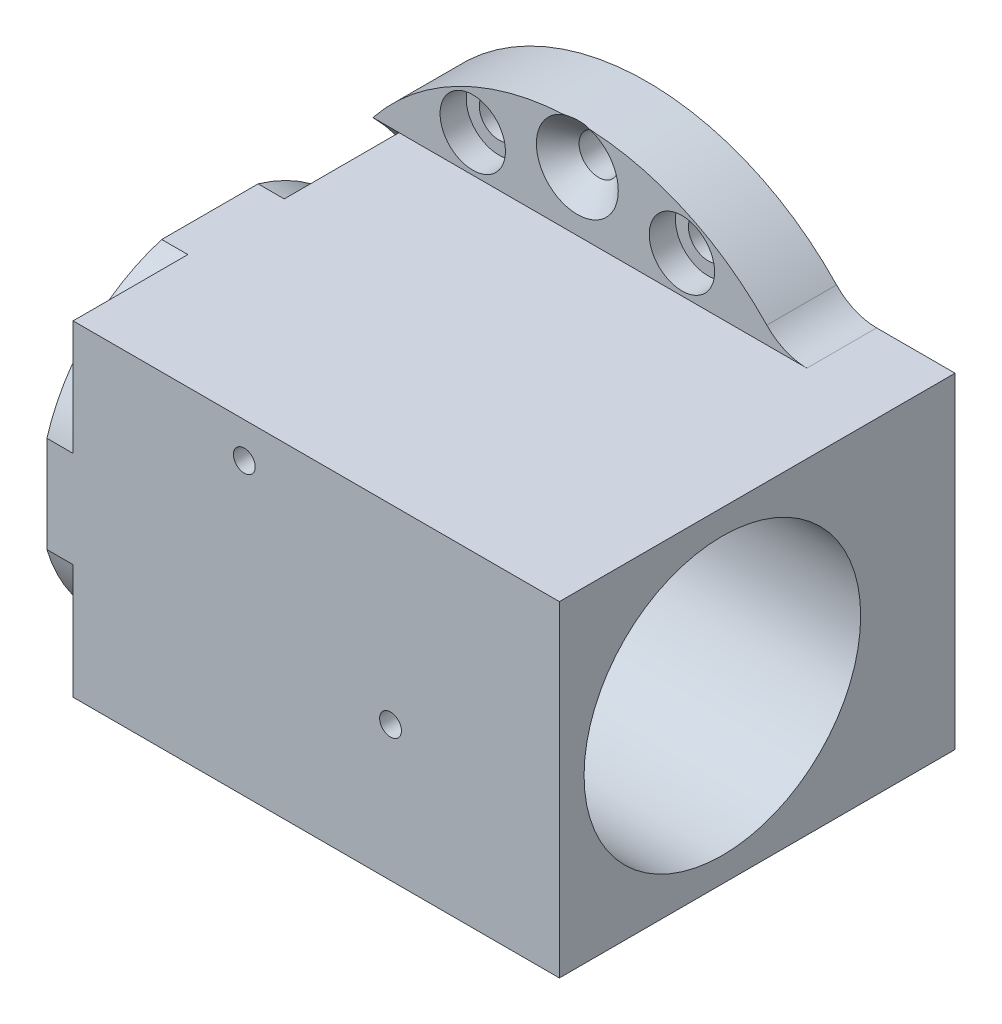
SolidWorks part; units mm, degrees
ref_plane "Front Plane" through (0, 0, 0) normal (0, 0, 1) x (1, 0, 0)
ref_plane "Top Plane" through (0, 0, 0) normal (0, 1, 0) x (1, 0, 0)
ref_plane "Right Plane" through (0, 0, 0) normal (1, 0, 0) x (0, 0, -1)
ref_plane "Plane1" through (0, 0, 8) normal (0, 0, 1) x (1, 0, 0)
sketch "Sketch1" plane through (0, 0, 8) normal (0, 0, 1) x (1, 0, 0)
  line L0 (-23.4587, 18.7) -> (-23.4587, -18.7)
  line L1 (23.4587, -18.7) -> (35.3413, -18.7)
  line L2 (35.3413, -18.7) -> (35.3413, 18.7)
  line L3 (35.3413, 18.7) -> (23.4587, 18.7)
  arc A0 (-23.4587, -18.7) -> (23.4587, -18.7) centre (0, 0) ccw
  arc A1 (23.4587, 18.7) -> (-23.4587, 18.7) centre (0, 0) ccw
extrude "Boss-Extrude1" add sketch "Sketch1" against normal blind 8
ref_plane "Plane2" through (-23.4587, 0, 0) normal (-1, 0, 0) x (0, -1, 0)
ref_plane "Plane3" through (-20.4587, 0, 0) normal (1, 0, 0) x (0, 0, -1)
sketch "Sketch3" plane through (-20.4587, 0, 0) normal (1, 0, 0) x (0, 0, -1)
  line L0 (-8, 18.7) -> (-8, -18.7)
  arc A0 (-8, -18.7) -> (-8, 18.7) centre (-26.7, 0) ccw
extrude "Cut-Extrude1" cut sketch "Sketch3" against normal up to surface
sketch "Sketch4" plane through (0, 0, 8) normal (0, 0, 1) x (1, 0, 0)
  line L0 (-20.4587, -18.7) -> (-20.4587, 18.7)
  line L1 (-20.4587, 18.7) -> (35.3413, 18.7)
  line L2 (35.3413, 18.7) -> (35.3413, -18.7)
  line L3 (35.3413, -18.7) -> (-20.4587, -18.7)
extrude "Boss-Extrude2" add sketch "Sketch4" along normal blind 37.4
sketch "Sketch5" plane through (-20.4587, 0, 0) normal (-1, 0, 0) x (0, 0, 1)
  line L0 (21.1719, 18.7) -> (45.4, 18.7)
  line L1 (45.4, 18.7) -> (45.4, -18.7)
  line L2 (45.4, -18.7) -> (21.1719, -18.7)
  arc A0 (21.1719, -18.7) -> (21.1719, 18.7) centre (26.7, 0) cw
extrude "Boss-Extrude3" add sketch "Sketch5" along normal blind 3
sketch "Sketch6" plane through (-23.4587, 0, 0) normal (-1, 0, 0) x (0, 0, 1)
  line L0 (45.4, -18.7) -> (45.4, -5.5281)
  line L1 (32.2281, -18.7) -> (45.4, -18.7)
  arc A0 (45.4, -5.5281) -> (32.2281, -18.7) centre (26.7, 0) cw
extrude "Cut-Extrude2" cut sketch "Sketch6" against normal blind 3
sketch "Sketch7" plane through (-23.4587, 0, 0) normal (-1, 0, 0) x (0, 0, 1)
  line L0 (45.4, 18.7) -> (32.2281, 18.7)
  line L1 (45.4, 5.5281) -> (45.4, 18.7)
  arc A0 (32.2281, 18.7) -> (45.4, 5.5281) centre (26.7, 0) cw
extrude "Cut-Extrude3" cut sketch "Sketch7" against normal blind 3
ref_plane "Plane4" through (0, 0, 26.7) normal (0, 0, 1) x (1, 0, 0)
sketch "Sketch8" plane through (0, 0, 26.7) normal (0, 0, 1) x (1, 0, 0)
  line L0 (-23.4587, 15.8686) -> (-23.4587, 0)
  line L1 (-23.4587, 0) -> (35.3413, 0)
  line L2 (35.3413, 0) -> (35.3413, 15.8687)
  line L3 (35.3413, 15.8687) -> (9.9413, 15.8687)
  line L4 (9.9413, 15.8687) -> (9.9413, 13.5)
  line L5 (9.9413, 13.5) -> (1.9413, 13.5)
  line L6 (1.9413, 13.5) -> (1.9413, 15.8686)
  line L7 (1.9413, 15.8686) -> (-23.4587, 15.8686)
  line L8 (-23.4587, 0) -> (35.3413, 0) construction
revolve "Cut-Revolve1" cut sketch "Sketch8" angle 360 about L8
hole_wizard "CSK for #8 Flat Head Machine Screw (100)1" positions "Sketch10" profile "Sketch9" countersink size "#8" standard "ANSI Inch"
sketch "Sketch10" plane through (0, 0, 8) normal (0, 0, 1) x (1, 0, 0)
  point P0 (0, 25.5)
  point P1 (0, -25.5)
sketch "Sketch9" plane through (0, 25.5, 8) normal (1, 0, 0) x (0, -1, 0)
  line L0 (0, 0) -> (0, 8)
  line L1 (0, 8) -> (2.25, 8)
  line L2 (2.25, 8) -> (2.25, 2.45)
  line L3 (2.25, 2.45) -> (4.7, 0)
  line L5 (4.7, 0) -> (0, 0)
  line L6 (-2.25, 2.45) -> (-4.7, 0) construction
  line L11 (0, -6.35) -> (0, 107.95) construction
  dimension "Thru Hole Dia." = 4.5
  dimension "Thru Hole Depth" = 8
  dimension "Near C'Sink Dia." = 9.4
  dimension "Near C'Sink Angle" = 90
hole_wizard "#4 Clearance Hole1" positions "Sketch12" profile "Sketch11" hole size "#4" standard "ANSI Inch"
sketch "Sketch12" plane through (0, -18.7, 0) normal (0, -1, 0) x (-1, 0, 0)
  point P0 (12.4587, -39.4)
  point P1 (-29.4413, -39.4)
  point P2 (-29.4413, -5.9)
sketch "Sketch11" plane through (-12.4587, -18.7, 39.4) normal (1, 0, 0) x (0, 0, -1)
  line L0 (0, 0) -> (0, 6)
  line L1 (0, 6) -> (1.65, 6)
  line L2 (1.65, 6) -> (1.65, 0)
  line L5 (1.65, 0) -> (0, 0)
  line L10 (0, 6) -> (-1.65, 6) construction
  line L11 (0, -6.35) -> (0, 107.95) construction
  dimension "Hole Dia." = 3.3
  dimension "Hole Depth" = 6
  dimension "Drill Angle" = 180
hole_wizard "CBORE for #8 Binding Head Machine Screw1" positions "Sketch14" profile "Sketch13" counterbore size "#8" standard "ANSI Inch"
sketch "Sketch14" plane through (0, 0, 8) normal (0, 0, 1) x (1, 0, 0)
  point P0 (12, 22.95)
  point P1 (-12, 22.95)
  point P2 (-12, -22.95)
  point P3 (12, -22.95)
sketch "Sketch13" plane through (12, 22.95, 8) normal (1, 0, 0) x (0, -1, 0)
  line L0 (0, 0) -> (0, 8)
  line L1 (0, 8) -> (2.25, 8)
  line L3 (2.25, 8) -> (2.25, 3)
  line L4 (2.25, 3) -> (3.75, 3)
  line L5 (3.75, 3) -> (3.75, 0)
  line L7 (3.75, 0) -> (0, 0)
  line L11 (0, -6.35) -> (0, 107.95) construction
  dimension "Thru Hole Dia." = 4.5
  dimension "Thru Hole Depth" = 8
  dimension "C'Bore Dia." = 7.5
  dimension "C'Bore Depth" = 3
hole_wizard "#2 Clearance Hole1" positions "Sketch16" profile "Sketch15" hole size "#2" standard "ANSI Inch"
sketch "Sketch16" plane through (0, 0, 45.4) normal (0, 0, 1) x (1, 0, 0)
  point P0 (-0.8087, 14.63)
sketch "Sketch15" plane through (-0.8087, 14.63, 45.4) normal (1, 0, 0) x (0, -1, 0)
  line L0 (0, 0) -> (0, 6)
  line L1 (0, 6) -> (1.25, 6)
  line L2 (1.25, 6) -> (1.25, 0)
  line L5 (1.25, 0) -> (0, 0)
  line L10 (0, 6) -> (-1.25, 6) construction
  line L11 (0, -6.35) -> (0, 107.95) construction
  dimension "Hole Dia." = 2.5
  dimension "Hole Depth" = 6
  dimension "Drill Angle" = 180
hole_wizard "#2 Clearance Hole2" positions "Sketch18" profile "Sketch17" hole size "#2" standard "ANSI Inch"
sketch "Sketch18" plane through (0, 0, 45.4) normal (0, 0, 1) x (1, 0, 0)
  point P0 (15.9651, -3.2)
sketch "Sketch17" plane through (15.9651, -3.2, 45.4) normal (1, 0, 0) x (0, -1, 0)
  line L0 (0, 0) -> (0, 3.1573)
  line L1 (0, 3.1573) -> (1.25, 3.1573)
  line L2 (1.25, 3.1573) -> (1.25, 0)
  line L5 (1.25, 0) -> (0, 0)
  line L11 (0, -6.35) -> (0, 107.95) construction
  dimension "Thru Hole Dia." = 2.5
  dimension "Thru Hole Depth" = 3.1573
fillet "Fillet1" radius 6.35 1 edges at (23.4587, 18.7, 4)
